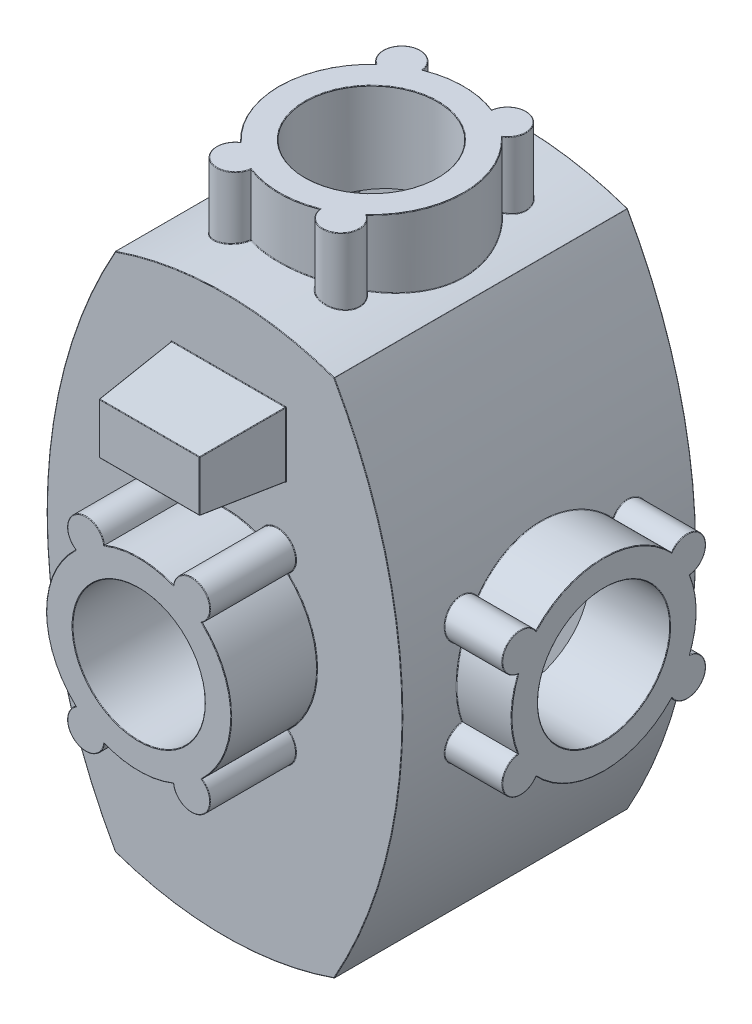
SolidWorks part; units mm, degrees
ref_plane "Ebene vorne" through (0, 0, 0) normal (0, 0, 1) x (1, 0, 0)
ref_plane "Ebene oben" through (0, 0, 0) normal (0, 1, 0) x (1, 0, 0)
ref_plane "Ebene rechts" through (0, 0, 0) normal (1, 0, 0) x (0, 0, -1)
imported_body "Guss-gehaeuse-1-surface1"
imported_body "Guss-gehaeuse-1-surface2"
imported_body "Guss-gehaeuse-1-surface3"
imported_body "Guss-gehaeuse-1-surface4"
imported_body "Guss-gehaeuse-2-surface1"
imported_body "Guss-gehaeuse-2-surface2"
imported_body "Guss-gehaeuse-2-surface3"
imported_body "Guss-gehaeuse-2-surface4"
imported_body "Guss-gehaeuse-3-surface1"
imported_body "Guss-gehaeuse-3-surface2"
imported_body "Guss-gehaeuse-3-surface3"
imported_body "Guss-gehaeuse-3-surface4"
delete or keep bodies "Körper-Löschen/beibehalten 1" type delete bodies bodies 102 103 104 106 107 108 110 111 112
delete or keep bodies "Körper-Löschen/beibehalten 2" [suppressed] type delete bodies bodies 105 109
delete or keep bodies "Körper-Löschen/beibehalten 4" type delete bodies bodies 101
delete or keep bodies "Körper-Löschen/beibehalten 5" type delete bodies bodies 105
delete or keep bodies "Körper-Löschen/beibehalten 3" [suppressed] type delete bodies bodies 109
